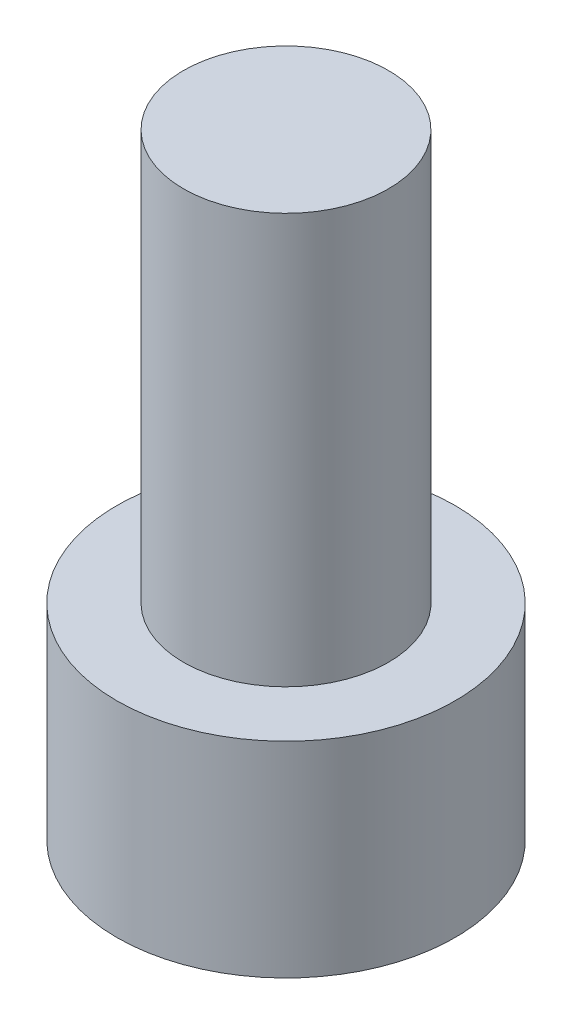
SolidWorks part; units mm, degrees
ref_plane "前视基准面" through (0, 0, 0) normal (0, 0, 1) x (1, 0, 0)
ref_plane "上视基准面" through (0, 0, 0) normal (0, 1, 0) x (1, 0, 0)
ref_plane "右视基准面" through (0, 0, 0) normal (1, 0, 0) x (0, 0, -1)
other "Configuration Table"
sketch "草图1" plane through (0, 0, 0) normal (0, 1, 0) x (1, 0, 0)
  circle A0 centre (0, 0) radius 6.6
  dimension "D1" = 13.2
extrude "凸台-拉伸1" add sketch "草图1" along normal blind 8
sketch "草图2" plane through (0, 8, 0) normal (0, 1, 0) x (1, 0, 0)
  circle A0 centre (0, 0) radius 4
  dimension "D1" = 8
extrude "凸台-拉伸2" add sketch "草图2" along normal blind 16
sketch "草图3" plane through (0, 0, 0) normal (0, -1, 0) x (1, 0, 0)
  line L1 (2.8052, -2.0324) -> (3.1627, 1.4132)
  line L2 (3.1627, 1.4132) -> (0.3575, 3.4456)
  line L3 (0.3575, 3.4456) -> (-2.8052, 2.0324)
  line L4 (-2.8052, 2.0324) -> (-3.1627, -1.4132)
  line L5 (-3.1627, -1.4132) -> (-0.3575, -3.4456)
  line L6 (-0.3575, -3.4456) -> (2.8052, -2.0324)
  circle A1 centre (0, 0) radius 3 construction
  dimension "D1" = 6
extrude "切除-拉伸1" cut sketch "草图3" against normal blind 4
